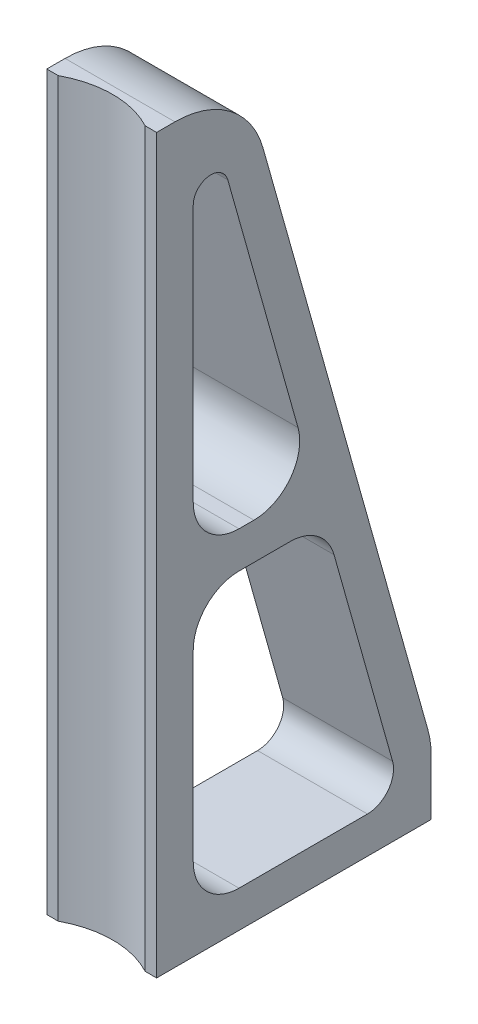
SolidWorks part; units mm, degrees
ref_plane "Front Plane" through (0, 0, 0) normal (0, 0, 1) x (1, 0, 0)
ref_plane "Top Plane" through (0, 0, 0) normal (0, 1, 0) x (1, 0, 0)
ref_plane "Right Plane" through (0, 0, 0) normal (1, 0, 0) x (0, 0, -1)
sketch "Sketch2" plane through (0, 0, 0) normal (1, 0, 0) x (0, 0, -1)
  line L0 (0, 0) -> (0, 50.8)
  line L1 (0, 50.8) -> (1.27, 50.8)
  line L2 (7.3828, 46.1692) -> (18.8128, 5.5292)
  line L3 (19.05, 0) -> (0, 0)
  line L4 (19.05, 3.81) -> (19.05, 0)
  arc A0 (1.27, 50.8) -> (7.3828, 46.1692) centre (1.27, 44.45) cw
  arc A1 (19.05, 3.81) -> (18.8128, 5.5292) centre (12.7, 3.81) ccw
  point P7 (5.08, 50.8)
  dimension "D4" = 6.35
  dimension "D5" = 6.35
  dimension "D1" = 50.8
  dimension "D2" = 5.08
  dimension "D3" = 19.05
  dimension "D6" = 1.27
  dimension "D7" = 3.81
extrude "Boss-Extrude1" add sketch "Sketch2" along normal mid plane 7.62
sketch "Sketch3" plane through (3.81, 0, 0) normal (1, 0, 0) x (0, 0, -1)
  line L5 (2.54, 2.54) -> (19.05, 2.54)
  line L6 (2.54, 50.8) -> (2.54, 2.54)
  line L7 (2.54, 2.54) -> (17.526, 2.54)
  line L8 (2.54, 49.1059) -> (2.54, 2.54)
  line L10 (17.3458, 5.1166) -> (5.9158, 45.7566)
  line L11 (17.3458, 5.1166) -> (5.9158, 45.7566)
  line L14 (17.526, 0) -> (17.526, 3.81)
  line L15 (17.526, 2.54) -> (17.526, 3.81)
  arc A6 (17.526, 3.81) -> (17.3458, 5.1166) centre (12.7, 3.81) ccw
  arc A7 (5.9158, 45.7566) -> (1.27, 49.276) centre (1.27, 44.45) ccw
  arc A8 (17.526, 3.81) -> (17.3458, 5.1166) centre (12.7, 3.81) ccw
  arc A9 (5.9158, 45.7566) -> (2.54, 49.1059) centre (1.27, 44.45) ccw
  dimension "D1" = 2.54
  dimension "D2" = 1.524
  dimension "D3" = 1.524
extrude "Cut-Extrude1" [suppressed] cut sketch "Sketch3" against normal offset from surface (2.54 mm away) 1.27
mirror "Mirror1" [suppressed] about plane through (0, 0, 0) normal (1, 0, 0)
sketch "Sketch4" plane through (0, 50.8, 0) normal (0, 1, 0) x (1, 0, 0)
  circle A0 centre (0, -5.588) radius 6.35
  dimension "D1" = 12.7
  dimension "D2" = 5.588
extrude "Cut-Extrude2" cut sketch "Sketch4" against normal through all
sketch "Sketch5" plane through (3.81, 0, 0) normal (1, 0, 0) x (0, 0, -1)
  line L0 (2.54, 21.59) -> (2.54, 2.54)
  line L1 (10.9428, 24.13) -> (4.9377, 45.4815)
  line L18 (2.54, 24.13) -> (10.9428, 24.13)
  line L19 (2.54, 21.59) -> (11.6572, 21.59)
  line L22 (2.54, 48.0421) -> (2.54, 2.54)
  line L23 (16.51, 2.54) -> (16.51, 3.81)
  line L24 (2.54, 2.54) -> (16.51, 2.54)
  line L25 (16.3677, 4.8415) -> (4.9377, 45.4815)
  line L26 (2.54, 45.1508) -> (2.54, 24.13)
  line L28 (2.54, 2.54) -> (14.6242, 2.54)
  line L29 (16.3677, 4.8415) -> (11.6572, 21.59)
  arc A0 (4.9377, 45.4815) -> (2.54, 45.1508) centre (3.7617, 45.1508) ccw
  arc A1 (14.6242, 2.54) -> (16.3677, 4.8415) centre (14.6242, 4.3512) ccw
  arc A6 (4.9377, 45.4815) -> (2.54, 48.0421) centre (1.27, 44.45) ccw
  arc A7 (16.51, 3.81) -> (16.3677, 4.8415) centre (12.7, 3.81) ccw
  dimension "D4" = 1.2217
  dimension "D2" = 2.54
  dimension "D3" = 19.05
  dimension "D1" = 2.54
extrude "Cut-Extrude3" cut sketch "Sketch5" against normal through all
fillet "Fillet1" radius 3.175 5 edges at (0, 21.59, -11.6572) (0, 21.59, -2.54) (0, 24.13, -10.9428) (0, 24.13, -2.54) (0, 2.54, -2.54)
